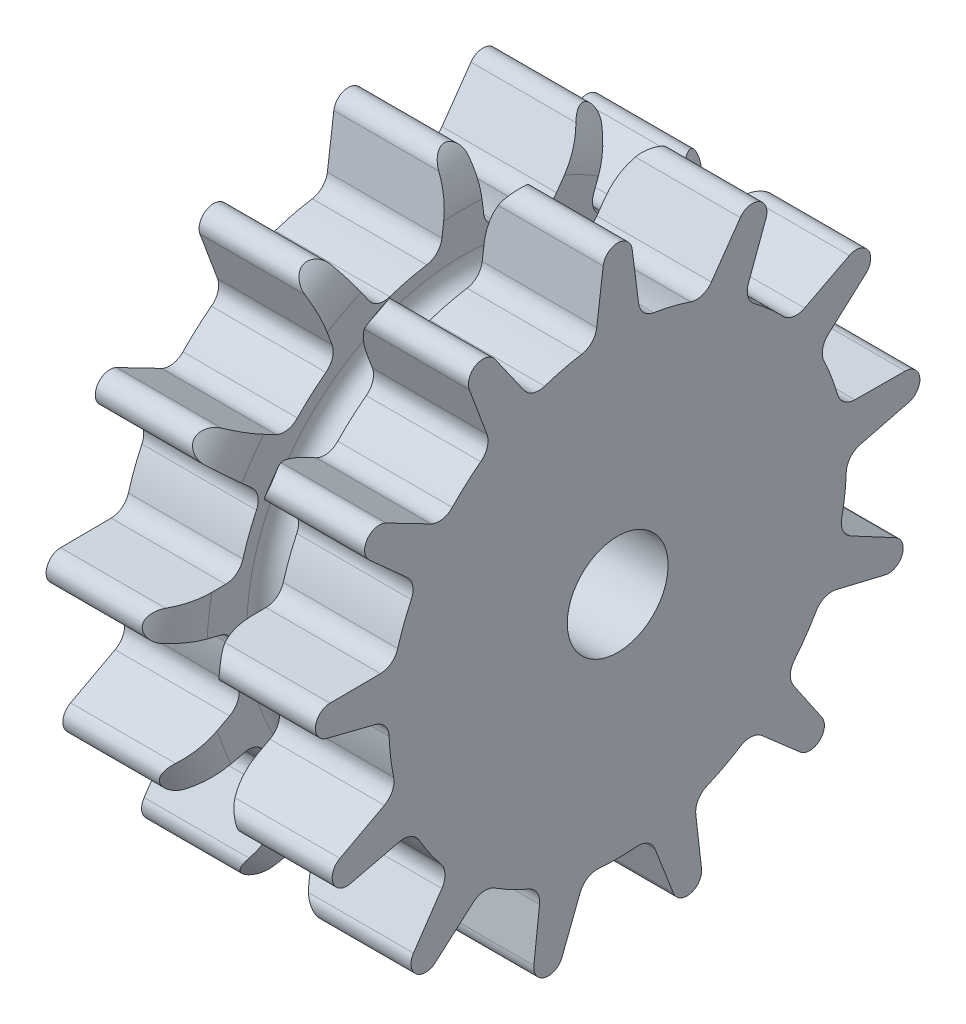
SolidWorks part; units mm, degrees
revolve "Body" add sketch "BasProSke" angle 360 about L0
sketch "BasProSke" plane through (0, 0, 0) normal (0, 1, 0) x (1, 0, 0)
  line L0 (-10, 0) -> (60, 0) construction
  line L1 (0, 0) -> (0, 9.5849)
  line L2 (0, 0) -> (8.4836, 0)
  line L3 (8.4836, 0) -> (8.4836, 9.5849)
  line L4 (8.4836, 9.5849) -> (0, 9.5849)
pattern_circular "TeethCutsRound" count 13 over 360 about axis through (0, 0, 0) along (1, 0, 0)
extrude "ToothCutRound" cut sketch "TooCutRouSke" along normal through all
sketch "TooCutRouSke" plane through (0, 0, 0) normal (1, 0, 0) x (0, 0, -1)
  line L0 (0, 0) -> (-26.0771, 105.7988) construction
  line L1 (0, 0) -> (0, 105.41) construction
  line L2 (-2.9512, 7.0417) -> (-3.8625, 8.3433)
  line L3 (-0.6593, 7.6066) -> (-0.4572, 9.1826)
  line L4 (36.7334, 9.6611) -> (-33.9089, 9.6611) construction
  line L5 (-33.9089, 7.0417) -> (0, 7.0417) construction
  line L6 (0, 9.5849) -> (0, 9.8389)
  line L7 (-4.4543, 8.487) -> (-4.5724, 8.7119)
  line L8 (-2.4831, 6.798) -> (0, 6.798) construction
  circle A0 centre (0, 0) radius 9.9502 construction
  circle A1 centre (-2.3813, 9.6611) radius 1.9693 construction
  arc A2 (0, 9.5849) -> (-0.4572, 9.1826) centre (0, 9.124) ccw
  arc A3 (-2.9512, 7.0417) -> (-2.3006, 6.828) centre (-2.4831, 7.3695) ccw
  arc A4 (-1.136, 7.115) -> (-2.3006, 6.828) centre (0, 0) ccw
  arc A5 (-1.136, 7.115) -> (-0.6593, 7.6066) centre (-1.2262, 7.6793) ccw
  circle A6 centre (0, 0) radius 7.6352 construction
  arc A7 (0, 9.8389) -> (-4.5724, 8.7119) centre (0, 0) ccw
  arc A8 (-4.4543, 8.487) -> (0, 9.5849) centre (0, 0) ccw construction
  arc A9 (-3.8625, 8.3433) -> (-4.4543, 8.487) centre (-4.2401, 8.0789) ccw
ref_plane "Plane1" through (0, 0, 0) normal (0, 0, 1) x (1, 0, 0)
ref_plane "Plane2" through (0, 0, 0) normal (0, 1, 0) x (1, 0, 0)
ref_plane "Plane3" through (0, 0, 0) normal (1, 0, 0) x (0, 0, -1)
other "Configuration Table"
sketch "Clipboard" plane through (0, 0, 0) normal (0, 1, 0) x (1, 0, 0)
  line L0 (0, 0) -> (4.6404, -1.0713)
  line L1 (-15, 0) -> (100, 0) construction
  line L2 (0, 0) -> (-1.5148, 1.7121)
  line L3 (0, 0) -> (-1.4236, 0.5441)
  line L4 (0, 0) -> (1.2374, 0.2857)
  line L5 (0, 0) -> (-11.8993, -4.4381)
  line L6 (0, 0) -> (-7.0326, -4.7449)
  line L7 (-1.5148, 1.7121) -> (1.2189, 14.1144)
  line L8 (-76.2, 38.1) -> (-72.771, 38.1)
  line L10 (-26.1335, 101.6321) -> (-12.5191, 101.3056)
  circle A0 centre (0, 0) radius 0.9846
  circle A1 centre (0, 0) radius 6.8072
  circle A2 centre (0, 0) radius 12.7
sketch "SidSke" plane through (0, 0, 0) normal (0, 1, 0) x (1, 0, 0)
  line L0 (-14.8342, 0) -> (55.1658, 0) construction
  line L1 (0, 9.5849) -> (0, -9.5849) construction
  line L2 (11.0236, 8.0609) -> (11.0236, 10.0929)
  line L3 (11.0236, 10.0929) -> (-2.54, 10.0929)
  line L4 (7.6344, 9.8389) -> (0.8492, 9.8389)
  line L5 (-2.54, 10.0929) -> (-2.54, 8.0609)
  line L6 (8.4836, 8.0609) -> (11.0236, 8.0609)
  line L7 (0, 8.0609) -> (-2.54, 8.0609)
  line L10 (0, 9.5849) -> (0, -9.5849) construction
  arc A0 (8.4836, 8.0609) -> (7.6344, 9.8389) centre (6.1976, 8.0609) ccw
  arc A1 (0, 8.0609) -> (0.8492, 9.8389) centre (2.286, 8.0609) cw
revolve "Sides" [suppressed] cut sketch "SidSke" angle 360 about L0
sketch "GrvSke" plane through (0, 0, 0) normal (0, 1, 0) x (1, 0, 0)
  line L0 (-14.8342, 0) -> (55.1658, 0) construction
  line L2 (4.2418, 40.64) -> (4.2418, 3.81) construction
  line L3 (4.8768, 8.0609) -> (4.8768, 6.8072)
  line L4 (3.6068, 6.8072) -> (3.6068, 8.0609)
  line L5 (2.7576, 9.8389) -> (5.726, 9.8389)
  arc A0 (4.8768, 6.8072) -> (3.6068, 6.8072) centre (4.2418, 6.8072) cw
  arc A1 (4.8768, 8.0609) -> (5.726, 9.8389) centre (7.1628, 8.0609) cw
  arc A2 (3.6068, 8.0609) -> (2.7576, 9.8389) centre (1.3208, 8.0609) ccw
revolve "Groove" cut sketch "GrvSke" angle 360 about L0
sketch "HubNeaOneSke" plane through (0, 0, 0) normal (-1, 0, 0) x (0, 0, 1)
  circle A0 centre (0, 0) radius 6.8072
extrude "HubNearOne" [suppressed] add sketch "HubNeaOneSke" along normal blind 4.2165
sketch "HubNeaBotSke" plane through (0, 0, 0) normal (-1, 0, 0) x (0, 0, 1)
  circle A0 centre (0, 0) radius 6.8072
extrude "HubNearBoth" [suppressed] add sketch "HubNeaBotSke" along normal blind 2.1082
ref_plane "FarPln" through (8.4836, 0, 0) normal (1, 0, 0) x (0, 0, -1)
sketch "HubFarSke" plane through (8.4836, 0, 0) normal (1, 0, 0) x (0, 0, -1)
  circle A0 centre (0, 0) radius 6.8072
extrude "HubFar" [suppressed] add sketch "HubFarSke" along normal blind 2.1082
sketch "BorSke" plane through (0, 0, 0) normal (1, 0, 0) x (0, 0, -1)
  circle A0 centre (0, 0) radius 1.5875
extrude "Bore" cut sketch "BorSke" along normal mid plane 25.4001
sketch "KeySke" plane through (0, 0, 0) normal (1, 0, 0) x (0, 0, -1)
  line L0 (-0.127, 0) -> (-0.127, 1.8415)
  line L1 (-0.127, 1.8415) -> (0.127, 1.8415)
  line L2 (0.127, 1.8415) -> (0.127, 0)
  line L3 (0, 0) -> (0, 34) construction
  line L4 (-0.127, 0) -> (0.127, 0)
extrude "Keyway" [suppressed] cut sketch "KeySke" along normal mid plane 25.4001
pattern_circular "Keyway2" [suppressed] count 2 every 90 about axis through (-10, 0, 0) along (1, 0, 0)
equation "\"MHD@Clipboard\" = \"Gmax@Clipboard\""
equation "\"OAL@Clipboard\" = \"Thickness@Clipboard\""
equation "\"MHD@Clipboard\" = ((sgn( \"MHD@Clipboard\" - \"Hub_dia@Clipboard\" )-1)*( \"MHD@Clipboard\" - \"Hub_dia@Clipboard\" ))/-2+ \"Hub_dia@Clipboard\""
equation "\"OAL@Clipboard\" = ((sgn( \"OAL@Clipboard\" - \"Overall_len@Clipboard\" )+1)*( \"OAL@Clipboard\" - \"Overall_len@Clipboard\" ))/2 + \"Overall_len@Clipboard\" + 0.000002"
equation "\"Num_teeth@TeethCutsRound\" = int( \"Show_teeth@Clipboard\" ) + 1"
equation "\"Num_teeth@TeethCutsRound\" = ((sgn( \"Num_teeth@TeethCutsRound\" - \"Num_teeth@Clipboard\" )-1)*( \"Num_teeth@TeethCutsRound\" - \"Num_teeth@Clipboard\" ))/-2+ \"Num_teeth@Clipboard\""
equation "\"Num_teeth@TeethCutsRound\" = ((sgn( \"Num_teeth@TeethCutsRound\" - 2.0)+1)*( \"Num_teeth@TeethCutsRound\" - 2.0))/2 +2.0"
equation "\"Angle@TeethCutsRound\" = 360.0 / \"Num_teeth@Clipboard\""
equation "\"Radius@TooCutRouSke\" =  \"Pitch@Clipboard\" / 2.0 / tan(3.14159265 / \"Num_teeth@Clipboard\" ) - 0.016 * \"Pitch@Clipboard\""
equation "\"Pitch_radius@TooCutRouSke\" = ( \"Pitch@Clipboard\" / 2.0) / sin(3.14159265 / \"Num_teeth@Clipboard\" )"
equation "\"Rot@TooCutRouSke\" = 180 / \"Num_teeth@Clipboard\""
equation "\"Gap_ang@TooCutRouSke\" = 70.0 - 360.0 / \"Num_teeth@Clipboard\""
equation "\"Rad@TooCutRouSke\" = 0.827 * \"Pitch@Clipboard\""
equation "\"WF_depth@TooCutRouSke\" = 0.55 * \"Pitch@Clipboard\""
equation "\"WF_fillet1@TooCutRouSke\" = 0.12 * \"Pitch@Clipboard\""
equation "\"WF_fillet2@TooCutRouSke\" = 0.12 * \"Pitch@Clipboard\""
equation "\"Diameter@BasProSke\" =  (\"Pitch@Clipboard\" / 2.0 / tan(3.14159265 / \"Num_teeth@Clipboard\" ) - 0.016 * \"Pitch@Clipboard\") * 2.0"
equation "\"Thickness@BasProSke\"  = \"Thickness@Clipboard\""
equation "\"Diameter@SidSke\" = (\"Pitch@Clipboard\" / 2.0 / tan(3.14159265 / \"Num_teeth@Clipboard\" ) - 0.016 * \"Pitch@Clipboard\") * 2.0 + 0.02"
equation "\"Thickness@SidSke\" = \"Thickness@Clipboard\""
equation "\"A_dim@SidSke\" = \"A_dim@Clipboard\" + 0.01"
equation "\"R_dim@SidSke\" = \"R_dim@Clipboard\""
equation "\"Diameter@GrvSke\" = (\"Pitch@Clipboard\" / 2.0 / tan(3.14159265 / \"Num_teeth@Clipboard\" ) - 0.016 * \"Pitch@Clipboard\") * 2.0 + 0.02"
equation "\"Offset@GrvSke\" = \"Thickness@Clipboard\" / 2.0 "
equation "\"A_dim@GrvSke\" = \"A_dim@Clipboard\" + 0.01"
equation "\"R_dim@GrvSke\" = \"R_dim@Clipboard\""
equation "\"Grv_wid@GrvSke\" = \"Grv_wid@Clipboard\""
equation "\"Gmax@GrvSke\" = \"Gmax@Clipboard\""
equation "\"Diameter@HubNeaOneSke\" = \"MHD@Clipboard\""
equation "\"Length@HubNearOne\" = \"OAL@Clipboard\" - \"Thickness@BasProSke\""
equation "\"Diameter@HubNeaBotSke\" = \"MHD@Clipboard\""
equation "\"Length@HubNearBoth\" = ( \"OAL@Clipboard\" - \"Thickness@BasProSke\" ) / 2.0"
equation "\"Thickness@FarPln\" = \"Thickness@BasProSke\""
equation "\"Diameter@HubFarSke\" = \"MHD@Clipboard\""
equation "\"Length@HubFar\" = ( \"OAL@Clipboard\" - \"Thickness@BasProSke\" ) / 2.0"
equation "\"D1@Bore\" = \"OAL@Clipboard\" * 2.0"
equation "\"D1@Keyway\" = \"OAL@Clipboard\" * 2.0"
equation "\"Offset@KeySke\" = \"T_dim@Clipboard\" - \"Diameter@BorSke\" / 2.0"
